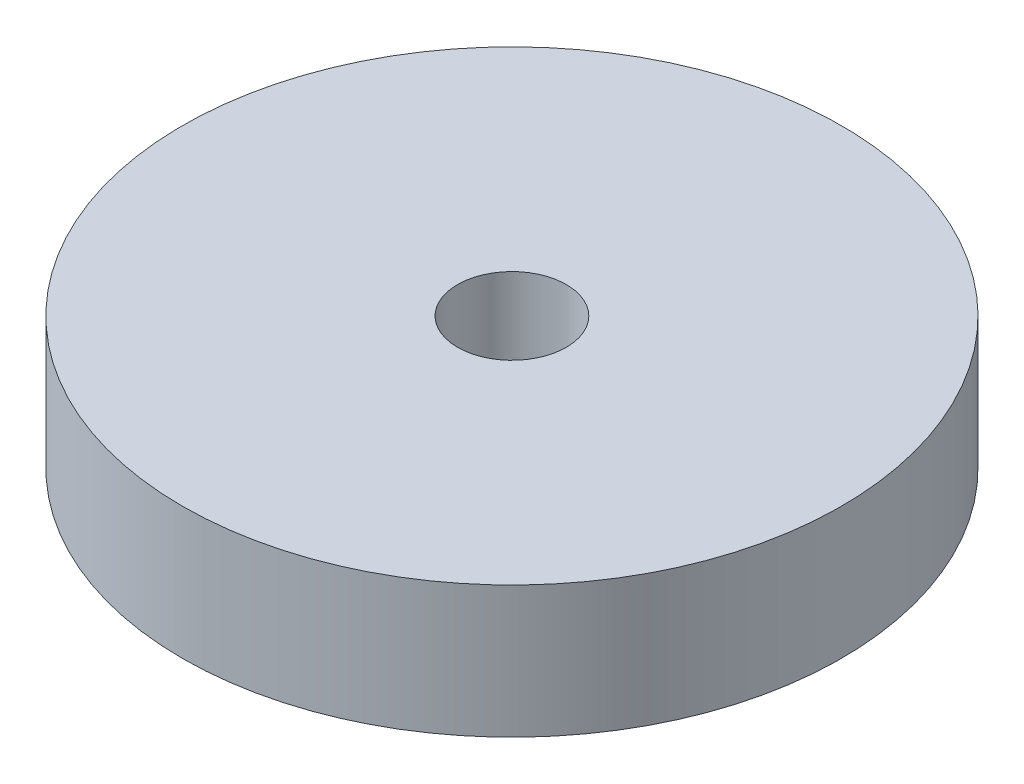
SolidWorks part; units mm, degrees
ref_plane "Front Plane" through (0, 0, 0) normal (0, 0, 1) x (1, 0, 0)
ref_plane "Top Plane" through (0, 0, 0) normal (0, 1, 0) x (1, 0, 0)
ref_plane "Right Plane" through (0, 0, 0) normal (1, 0, 0) x (0, 0, -1)
sketch "Sketch1" plane through (0, 0, 0) normal (0, 1, 0) x (1, 0, 0)
  circle A0 centre (0, 0) radius 10
  dimension "D1" = 20
extrude "Extrude1" add sketch "Sketch1" along normal blind 4
hole_wizard "M4 Tapped Hole1" positions "3DSketch1" profile "Sketch3" tap size "M4" standard "ISO"
sketch3d "3DSketch1"
  line L0 (0, 4, 0) -> (0, 0, 0) construction
  point P0 (0, 4, 0)
sketch "Sketch3" plane through (0, 4, 0) normal (1, 0, 0) x (0, 0, 1)
  line L0 (0, 0) -> (0, 4)
  line L1 (0, 4) -> (1.65, 4)
  line L2 (1.65, 4) -> (1.65, 0)
  line L5 (1.65, 0) -> (0, 0)
  line L11 (0, -6.35) -> (0, 107.95) construction
  dimension "Thru Tap Drill Dia." = 3.3
  dimension "Thru Tap Drill Depth" = 4
